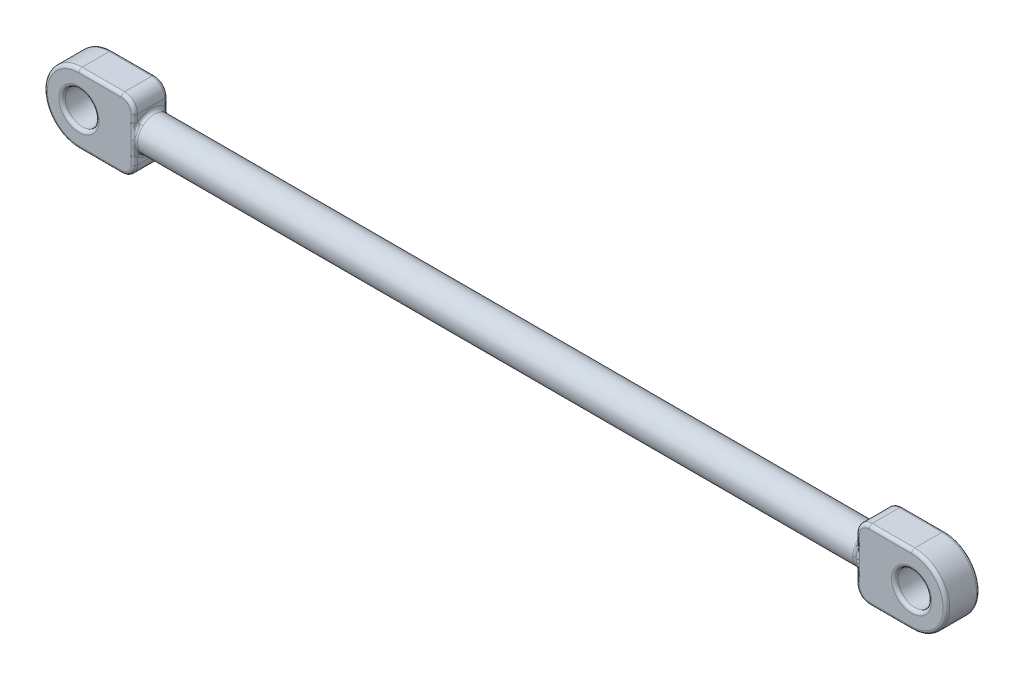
SolidWorks part; units mm, degrees
ref_plane "Front Plane" through (0, 0, 0) normal (0, 0, 1) x (1, 0, 0)
ref_plane "Top Plane" through (0, 0, 0) normal (0, 1, 0) x (1, 0, 0)
ref_plane "Right Plane" through (0, 0, 0) normal (1, 0, 0) x (0, 0, -1)
sketch "Sketch1" plane through (0, 0, 0) normal (0, 0, 1) x (1, 0, 0)
  line L0 (0, 8.5852) -> (0, -8.5852) construction
  line L9 (0, -8.5852) -> (13.6398, -8.5852)
  line L10 (13.6398, -8.5852) -> (13.6398, 8.5852)
  line L11 (13.6398, 8.5852) -> (0, 8.5852)
  arc A0 (0, 8.5852) -> (0, -8.5852) centre (0, 0) ccw
  dimension "D1" = 17.1704
  dimension "D2" = 22.225
extrude "Extrude1" add sketch "Sketch1" along normal mid plane 8.255
sketch "Sketch2" plane through (0, 0, 4.1275) normal (0, 0, 1) x (1, 0, 0)
  circle A0 centre (0, 0) radius 4.1275
  dimension "D1" = 8.255
extrude "Cut-Extrude1" cut sketch "Sketch2" against normal through all
sketch "Sketch3" plane through (13.6398, 0, 0) normal (1, 0, 0) x (0, 0, -1)
  circle A0 centre (0, 0) radius 4.1275
  dimension "D1" = 8.255
extrude "Extrude2" add sketch "Sketch3" along normal blind 88.9
mirror "Mirror1" about plane through (102.5398, 0, 0) normal (1, 0, 0)
fillet "Fillet4" radius 3.175 4 edges at (191.4398, -8.5852, 0) (191.4398, 8.5852, 0) (13.6398, -8.5852, 0) (13.6398, 8.5852, 0)
fillet "Fillet3" radius 0.8128 36 edges at (191.4398, 4.1275, 0) (191.4398, -4.1275, 0) (200.9521, 0, 4.1275) (200.9521, 0, -4.1275) (199.8472, 8.5852, -4.1275) (199.8472, -8.5852, -4.1275) (191.4398, -2.7051, -4.1275) (191.4398, 2.7051, -4.1275) (199.8472, 8.5852, 4.1275) (199.8472, -8.5852, 4.1275) (191.4398, -2.7051, 4.1275) (191.4398, 2.7051, 4.1275) (13.6398, 4.1275, 0) (13.6398, -4.1275, 0) (4.1275, 0, 4.1275) (4.1275, 0, -4.1275) (5.2324, 8.5852, -4.1275) (5.2324, -8.5852, -4.1275) (13.6398, -2.7051, -4.1275) (13.6398, 2.7051, -4.1275) (5.2324, 8.5852, 4.1275) (5.2324, -8.5852, 4.1275) (13.6398, -2.7051, 4.1275) (13.6398, 2.7051, 4.1275) (213.6648, 0, -4.1275) (213.6648, 0, 4.1275) (-8.5852, 0, -4.1275) (-8.5852, 0, 4.1275) (192.3697, -7.6553, -4.1275) (192.3697, 7.6553, -4.1275) (192.3697, -7.6553, 4.1275) (192.3697, 7.6553, 4.1275) (12.7099, -7.6553, -4.1275) (12.7099, 7.6553, -4.1275) (12.7099, -7.6553, 4.1275) (12.7099, 7.6553, 4.1275)
